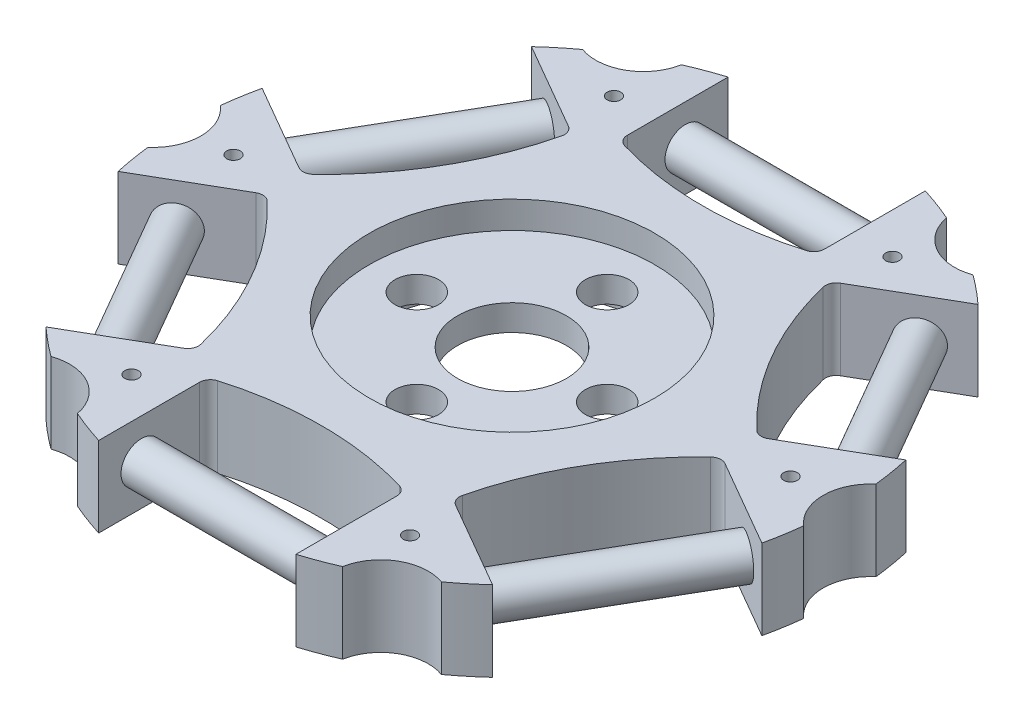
SolidWorks part; units mm, degrees
ref_plane "前视基准面" through (0, 0, 0) normal (0, 0, 1) x (1, 0, 0)
ref_plane "上视基准面" through (0, 0, 0) normal (0, 1, 0) x (1, 0, 0)
ref_plane "右视基准面" through (0, 0, 0) normal (1, 0, 0) x (0, 0, -1)
ref_plane "基准面4" through (0, 0, 0) normal (0, 0, -1) x (-1, 0, 0)
sketch "草图1" plane through (0, 0, 0) normal (0, 0, -1) x (-1, 0, 0)
  line L0 (-24.25, -3) -> (0, -3)
  line L1 (0, -3) -> (0, 2.9)
  line L2 (0, 2.9) -> (-24.25, 2.9)
  line L3 (-24.25, 2.9) -> (-24.25, -3)
  line L4 (0, -3) -> (0, 2.9) construction
revolve "旋转1" add sketch "草图1" angle 360 about L4
sketch "草图2" plane through (0, 2.9, 0) normal (0, 1, 0) x (-1, 0, 0)
  line L0 (-7.25, 23.1409) -> (-7.25, 15.1409)
  line L1 (7.25, 15.1409) -> (7.25, 23.1409)
  arc A0 (7.25, 23.1409) -> (-7.25, 23.1409) centre (0, 0) ccw
  arc A1 (-7.25, 15.1409) -> (7.25, 15.1409) centre (0, 37.6065) ccw
extrude "切除-拉伸1" cut sketch "草图2" against normal through all
sketch "草图3" plane through (0, 2.9, 0) normal (0, 1, 0) x (-1, 0, 0)
  arc A0 (14.3544, 19.5451) -> (9.7494, 22.2039) centre (0, 0) ccw
  arc A1 (9.7494, 22.2039) -> (14.3544, 19.5451) centre (13.19, 22.8458) ccw
extrude "切除-拉伸2" cut sketch "草图3" against normal through all
sketch "草图4" plane through (0, 2.9, 0) normal (0, 1, 0) x (-1, 0, 0)
  line L0 (16.4156, 17.8491) -> (9.4874, 13.8491)
  line L1 (16.7374, 1.2918) -> (23.6656, 5.2918)
  arc A0 (23.6656, 5.2918) -> (16.4156, 17.8491) centre (0, 0) ccw
  arc A1 (9.4874, 13.8491) -> (16.7374, 1.2918) centre (32.5682, 18.8033) ccw
extrude "切除-拉伸3" cut sketch "草图4" against normal through all
sketch "草图5" plane through (0, 2.9, 0) normal (0, 1, 0) x (-1, 0, 0)
  arc A0 (24.1038, -2.6587) -> (24.1038, 2.6587) centre (0, 0) ccw
  arc A1 (24.1038, 2.6587) -> (24.1038, -2.6587) centre (26.38, 0) ccw
extrude "切除-拉伸4" cut sketch "草图5" against normal through all
sketch "草图6" plane through (0, 2.9, 0) normal (0, 1, 0) x (-1, 0, 0)
  line L0 (23.6656, -5.2918) -> (16.7374, -1.2918)
  line L1 (9.4874, -13.8491) -> (16.4156, -17.8491)
  arc A0 (16.4156, -17.8491) -> (23.6656, -5.2918) centre (0, 0) ccw
  arc A1 (16.7374, -1.2918) -> (9.4874, -13.8491) centre (32.5682, -18.8033) ccw
extrude "切除-拉伸5" cut sketch "草图6" against normal through all
sketch "草图7" plane through (0, 2.9, 0) normal (0, 1, 0) x (-1, 0, 0)
  arc A0 (9.7494, -22.2039) -> (14.3544, -19.5451) centre (0, 0) ccw
  arc A1 (14.3544, -19.5451) -> (9.7494, -22.2039) centre (13.19, -22.8458) ccw
extrude "切除-拉伸6" cut sketch "草图7" against normal through all
sketch "草图8" plane through (0, 2.9, 0) normal (0, 1, 0) x (-1, 0, 0)
  line L0 (7.25, -23.1409) -> (7.25, -15.1409)
  line L1 (-7.25, -15.1409) -> (-7.25, -23.1409)
  arc A0 (-7.25, -23.1409) -> (7.25, -23.1409) centre (0, 0) ccw
  arc A1 (7.25, -15.1409) -> (-7.25, -15.1409) centre (0, -37.6065) ccw
extrude "切除-拉伸7" cut sketch "草图8" against normal through all
sketch "草图9" plane through (0, 2.9, 0) normal (0, 1, 0) x (-1, 0, 0)
  arc A0 (-14.3544, -19.5451) -> (-9.7494, -22.2039) centre (0, 0) ccw
  arc A1 (-9.7494, -22.2039) -> (-14.3544, -19.5451) centre (-13.19, -22.8458) ccw
extrude "切除-拉伸8" cut sketch "草图9" against normal through all
sketch "草图10" plane through (0, 2.9, 0) normal (0, 1, 0) x (-1, 0, 0)
  line L0 (-16.4156, -17.8491) -> (-9.4874, -13.8491)
  line L1 (-16.7374, -1.2918) -> (-23.6656, -5.2918)
  arc A0 (-23.6656, -5.2918) -> (-16.4156, -17.8491) centre (0, 0) ccw
  arc A1 (-9.4874, -13.8491) -> (-16.7374, -1.2918) centre (-32.5682, -18.8033) ccw
extrude "切除-拉伸9" cut sketch "草图10" against normal through all
sketch "草图11" plane through (0, 2.9, 0) normal (0, 1, 0) x (-1, 0, 0)
  arc A0 (-24.1038, 2.6587) -> (-24.1038, -2.6587) centre (0, 0) ccw
  arc A1 (-24.1038, -2.6587) -> (-24.1038, 2.6587) centre (-26.38, 0) ccw
extrude "切除-拉伸10" cut sketch "草图11" against normal through all
sketch "草图12" plane through (0, 2.9, 0) normal (0, 1, 0) x (-1, 0, 0)
  line L0 (-23.6656, 5.2918) -> (-16.7374, 1.2918)
  line L1 (-9.4874, 13.8491) -> (-16.4156, 17.8491)
  arc A0 (-16.4156, 17.8491) -> (-23.6656, 5.2918) centre (0, 0) ccw
  arc A1 (-16.7374, 1.2918) -> (-9.4874, 13.8491) centre (-32.5682, 18.8033) ccw
extrude "切除-拉伸11" cut sketch "草图12" against normal through all
sketch "草图13" plane through (0, 2.9, 0) normal (0, 1, 0) x (-1, 0, 0)
  arc A0 (-9.7494, 22.2039) -> (-14.3544, 19.5451) centre (0, 0) ccw
  arc A1 (-14.3544, 19.5451) -> (-9.7494, 22.2039) centre (-13.19, 22.8458) ccw
extrude "切除-拉伸12" cut sketch "草图13" against normal through all
sketch "草图14" plane through (0, 0, 0) normal (0, 0, 1) x (1, 0, 0)
  line L0 (10.5, 2.9) -> (0, 2.9)
  line L1 (0, 2.9) -> (0, -3)
  line L2 (0, -3) -> (10.5, -3)
  line L3 (10.5, -3) -> (10.5, -1)
  line L4 (10.5, -1) -> (4, -1)
  line L5 (4, -1) -> (4, 0.9)
  line L6 (4, 0.9) -> (10.5, 0.9)
  line L7 (10.5, 0.9) -> (10.5, 2.9)
  line L8 (0, 2.9) -> (0, -3) construction
  dimension "D1" = 2
  dimension "D2" = 2
  dimension "D3" = 5.9
revolve "切除-旋转1" cut sketch "草图14" angle 360 about L8
ref_plane "基准面5" through (0, 0, 20) normal (0, 0, -1) x (-1, 0, 0)
sketch "草图15" plane through (0, 0, 20) normal (0, 0, -1) x (-1, 0, 0)
  line L0 (-7.25, 1.45) -> (-7.25, -0.05)
  line L1 (-7.25, -0.05) -> (7.25, -0.05)
  line L2 (7.25, -0.05) -> (7.25, 1.45)
  line L3 (7.25, 1.45) -> (-7.25, 1.45)
  line L4 (-7.25, -0.05) -> (7.25, -0.05) construction
  line L5 (7.25, 2.9) -> (-7.25, 2.9) construction
  dimension "D1" = 1.5
  dimension "D2" = 2.95
revolve "旋转2" add sketch "草图15" angle 360 about L4
ref_plane "基准面6" through (0, 0, 0) normal (0, -1, 0) x (1, 0, 0)
hole_wizard "Ø3.2 (3.2) 直径孔1" positions "草图22" profile "草图21" hole size "Ø3.2" standard "ANSI Metric"
sketch "草图22" plane through (0, -1, 0) normal (0, -1, 0) x (-1, 0, 0)
  point P0 (0, 7)
  point P1 (0, -7)
  point P2 (-7, 0)
  point P3 (7, 0)
sketch "草图21" plane through (0, -1, -7) normal (1, 0, 0) x (0, 0, -1)
  line L0 (0, 0) -> (0, 3.9)
  line L1 (0, 3.9) -> (1.6, 3.9)
  line L2 (1.6, 3.9) -> (1.6, 0)
  line L5 (1.6, 0) -> (0, 0)
  line L11 (0, -6.35) -> (0, 107.95) construction
  dimension "通孔孔直径" = 3.2
  dimension "通孔孔深度" = 3.9
fillet "圆角1" radius 0.8 12 edges at (-16.7374, -0.05, -1.2918) (7.25, -0.05, 15.1409) (-9.4874, -0.05, 13.8491) (16.7374, -0.05, 1.2918) (-9.4874, -0.05, -13.8491) (16.7374, -0.05, -1.2918) (-16.7374, -0.05, 1.2918) (9.4874, -0.05, -13.8491) (-7.25, -0.05, 15.1409) (7.25, -0.05, -15.1409) (9.4874, -0.05, 13.8491) (-7.25, -0.05, -15.1409)
sketch "草图23" plane through (0, -3, 0) normal (0, -1, 0) x (1, 0, 0)
  circle A3 centre (20.48, 0) radius 0.5
extrude "切除-拉伸13" cut sketch "草图23" against normal blind 10
pattern_circular "阵列(圆周)1" count 6 over 360 about axis through (0, 0, 0) along (0, 1, 0) of "切除-拉伸13"
pattern_circular "阵列(圆周)2" count 6 over 360 about axis through (0, 2.9, 0) along (0, -1, 0) of "旋转2"
